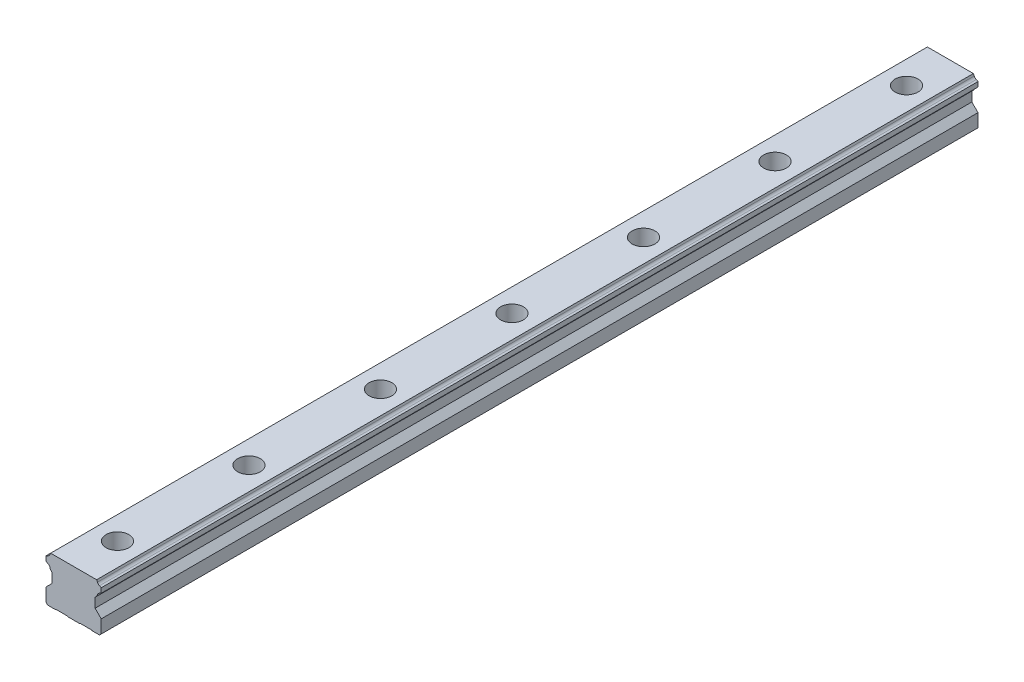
SolidWorks part; units mm, degrees
ref_plane "Front Plane" through (0, 0, 0) normal (0, 0, 1) x (1, 0, 0)
ref_plane "Top Plane" through (0, 0, 0) normal (0, 1, 0) x (1, 0, 0)
ref_plane "Right Plane" through (0, 0, 0) normal (1, 0, 0) x (0, 0, -1)
sketch "Sketch1" plane through (0, 0, 0) normal (0, 0, 1) x (1, 0, 0)
  line L0 (31.5, 17) -> (31.5, 2)
  line L1 (24.5, 24) -> (31.5, 17)
  line L2 (24.5, 34.8) -> (24.5, 24)
  line L3 (26.6979, 36.998) -> (24.5, 34.8)
  line L4 (31.5, 42.271) -> (29.5139, 41.3382)
  line L5 (31.5, 47.73) -> (31.5, 42.271)
  line L6 (29.5157, 48.661) -> (31.5, 47.73)
  line L7 (26.23, 53) -> (27.161, 51.0157)
  line L8 (-26.23, 53) -> (26.23, 53)
  line L9 (-27.161, 51.0157) -> (-26.23, 53)
  line L10 (-31.5, 47.73) -> (-29.5157, 48.661)
  line L11 (-31.5, 42.271) -> (-31.5, 47.73)
  line L12 (-29.5139, 41.3382) -> (-31.5, 42.271)
  line L13 (-24.5, 34.8) -> (-26.6979, 36.998)
  line L14 (-24.5, 24) -> (-24.5, 34.8)
  line L15 (-31.5, 17) -> (-24.5, 24)
  line L16 (-31.5, 2) -> (-31.5, 17)
  line L17 (-29.5, 0) -> (-31.5, 2)
  line L18 (-21, 0) -> (-29.5, 0)
  line L19 (-20.5, 0.5) -> (-21, 0)
  line L20 (-7.7071, 0.5) -> (-20.5, 0.5)
  line L21 (-7, 0) -> (-7.3536, 0.3536)
  line L22 (7, 0) -> (-7, 0)
  line L23 (7.3536, 0.3536) -> (7, 0)
  line L24 (20.5, 0.5) -> (7.7071, 0.5)
  line L25 (21, 0) -> (20.5, 0.5)
  line L26 (29.5, 0) -> (21, 0)
  line L27 (31.5, 2) -> (29.5, 0)
  arc A0 (29.5139, 41.3382) -> (26.6979, 36.998) centre (31.597, 36.903) ccw
  arc A1 (27.161, 51.0157) -> (29.5157, 48.661) centre (31.597, 53.097) ccw
  arc A2 (-29.5157, 48.661) -> (-27.161, 51.0157) centre (-31.597, 53.097) ccw
  arc A3 (-26.6979, 36.998) -> (-29.5139, 41.3382) centre (-31.597, 36.903) ccw
  arc A4 (-7.3536, 0.3536) -> (-7.7071, 0.5) centre (-7.7071, 0) ccw
  arc A5 (7.7071, 0.5) -> (7.3536, 0.3536) centre (7.7071, 0) ccw
extrude "Boss-Extrude1" add sketch "Sketch1" along normal mid plane 1000 contours L8 L7 A1 L6 L5 L4 A0 L3 L2 L1 L0 L27 L26 L25 L24 A5 L23 L22 L21 A4 L20 L19 L18 L17 L16 L15 L14 L13 A3 L12 L11 L10 A2 L9
hole_wizard "CBORE for M12 Hex Socket Head Cap Screw1" positions "Sketch2" profile "Sketch3" counterbore size "M12" standard "DIN"
sketch "Sketch2" plane through (0, 53, 0) normal (0, 1, 0) x (1, 0, 0)
  line L0 (-26.23, -500) -> (26.23, -500) construction
  point P0 (0, -450)
  point P5 (0, 0)
  dimension "D1" = 50
sketch "Sketch3" plane through (0, 53, 450) normal (1, 0, 0) x (0, 0, 1)
  line L0 (0, 0) -> (0, 53)
  line L1 (0, 53) -> (9, 53)
  line L3 (9, 53) -> (9, 22)
  line L4 (9, 22) -> (13, 22)
  line L5 (13, 22) -> (13, 0)
  line L7 (13, 0) -> (0, 0)
  line L11 (0, -6.35) -> (0, 107.95) construction
  dimension "Thru Hole Dia." = 18
  dimension "Thru Hole Depth" = 53
  dimension "C'Bore Dia." = 26
  dimension "C'Bore Depth" = 22
pattern_linear "LPattern1" count 7 spacing 150 along (0, 0, -1) of "CBORE for M12 Hex Socket Head Cap Screw1"
